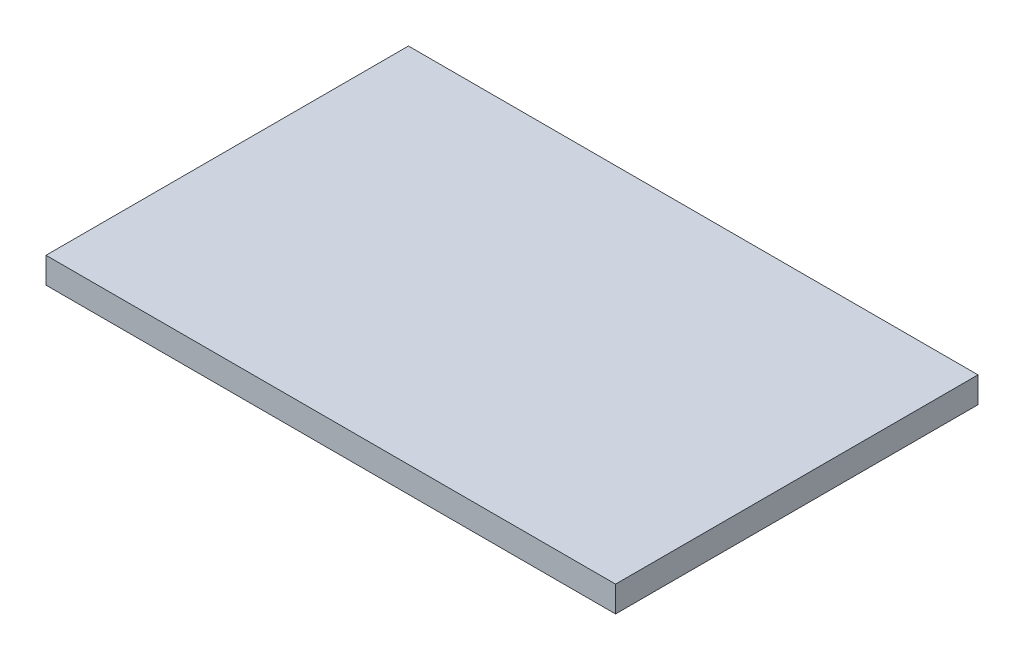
SolidWorks part; units mm, degrees
ref_plane "Front Plane" through (0, 0, 0) normal (0, 0, 1) x (1, 0, 0)
ref_plane "Top Plane" through (0, 0, 0) normal (0, 1, 0) x (1, 0, 0)
ref_plane "Right Plane" through (0, 0, 0) normal (1, 0, 0) x (0, 0, -1)
sketch "Sketch1" plane through (0, 0, 0) normal (0, 1, 0) x (1, 0, 0)
  line L1 (55, -35) -> (-55, -35)
  line L2 (55, -35) -> (55, 35)
  line L3 (55, 35) -> (-55, 35)
  line L4 (-55, -35) -> (-55, 35)
  line L5 (55, -35) -> (-55, 35) construction
  line L6 (55, 35) -> (-55, -35) construction
  point P0 (0, 0)
  dimension "D1" = 70
  dimension "D2" = 110
extrude "Boss-Extrude1" add sketch "Sketch1" along normal blind 5
